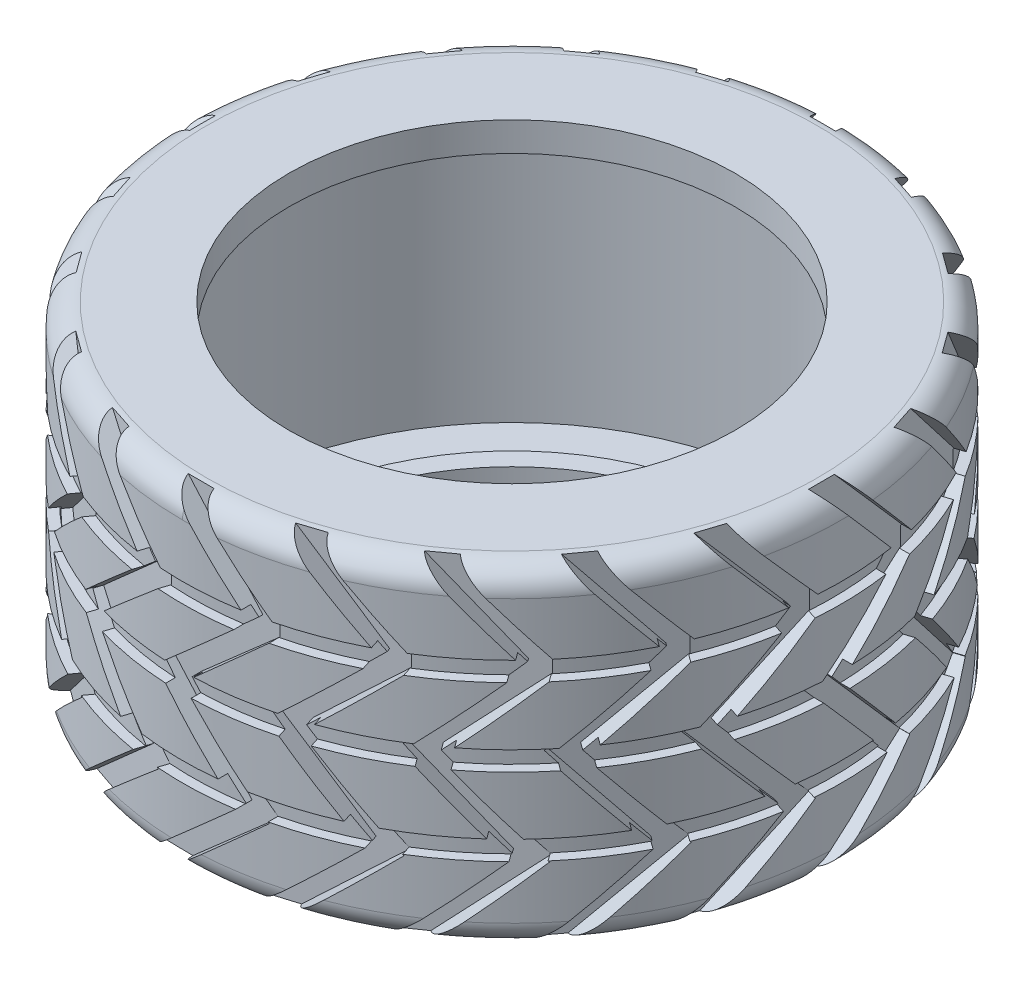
SolidWorks part; units mm, degrees
ref_plane "Front Plane" through (0, 0, 0) normal (0, 0, 1) x (1, 0, 0)
ref_plane "Top Plane" through (0, 0, 0) normal (0, 1, 0) x (1, 0, 0)
ref_plane "Right Plane" through (0, 0, 0) normal (1, 0, 0) x (0, 0, -1)
sketch "Sketch1" plane through (0, 0, 0) normal (0, 0, 1) x (1, 0, 0)
  line L0 (0, 83.6379) -> (0, -103.1897) construction
  line L1 (31.5, -17) -> (23, -17)
  line L2 (23, -17) -> (23, -14)
  line L3 (23, -14) -> (25, -14)
  line L4 (25, -14) -> (25, -15)
  line L5 (30, 15) -> (30, -15)
  line L6 (25, -15) -> (30, -15)
  line L7 (25, 15) -> (30, 15)
  line L8 (25, 14) -> (25, 15)
  line L9 (23, 14) -> (25, 14)
  line L10 (-63.3434, 0) -> (34, 0) construction
  line L11 (23, 17) -> (23, 14)
  line L12 (34, 14.5) -> (34, -14.5)
  line L13 (31.5, 17) -> (23, 17)
  arc A0 (34, -14.5) -> (31.5, -17) centre (31.5, -14.5) cw
  arc A1 (34, 14.5) -> (31.5, 17) centre (31.5, 14.5) ccw
  point P19 (34, -19)
  point P21 (30, 0)
  point P24 (34, 19)
  dimension "D8" = 2.5
  dimension "D1" = 30
  dimension "D2" = 2
  dimension "D3" = 2
  dimension "D4" = 15
  dimension "D5" = 3
  dimension "D6" = 5
  dimension "D7" = 4
revolve "Revolve1" add sketch "Sketch1" angle 360 about L0
sketch "Sketch2" plane through (0, 0, 0) normal (0, 0, 1) x (1, 0, 0)
  line L0 (-5.8704, 0) -> (53.8139, 0) construction
  line L1 (33, 9) -> (35.7422, 9)
  line L2 (33, 9) -> (33, 7)
  line L3 (33, 7) -> (35.7422, 7)
  line L4 (35.7422, 9) -> (35.7422, 7)
  line L5 (33, 1) -> (35.7422, 1)
  line L6 (33, 1) -> (33, -1)
  line L7 (33, -1) -> (35.7422, -1)
  line L8 (35.7422, 1) -> (35.7422, -1)
  line L9 (33, -7) -> (35.7422, -7)
  line L10 (33, -7) -> (33, -9)
  line L11 (33, -9) -> (35.7422, -9)
  line L12 (35.7422, -7) -> (35.7422, -9)
  line L13 (34, -14.5) -> (34, 14.5) construction
  line L14 (0, 29.8282) -> (0, -32.6074) construction
  line L15 (0, -32.6074) -> (-0.69, -32.6074) construction
  dimension "D1" = 2
  dimension "D2" = 1
  dimension "D3" = 9
revolve "Cut-Revolve1" cut sketch "Sketch2" angle 360 about L14
ref_plane "Plane1" through (34, 0, 0) normal (1, 0, 0) x (0, 0, -1)
sketch "Sketch3" plane through (34, 0, 0) normal (1, 0, 0) x (0, 0, -1)
  line L0 (0, 0) -> (9.1133, 8)
  line L1 (9.1133, 8) -> (1.1133, 17.1133)
  line L2 (0, 0) -> (8, -9.1133)
  line L3 (8, -9.1133) -> (-1.1133, -17.1133)
  line L4 (2.3901, 8) -> (13.9243, 8) construction
  line L5 (0, 18.3998) -> (0, -22.4709) construction
  line L6 (6.2909, 8.1836) -> (-0.3897, 15.7939) construction
  line L7 (1.1133, 17.1133) -> (-1.548, 17.1133)
  line L8 (-0.2479, 15.6324) -> (-1.548, 17.1133)
  line L9 (-2.4327, -15.6103) -> (-4.1449, -17.1133)
  line L10 (-33, 9) -> (33, 9) construction
  line L11 (34, 7) -> (-34, 7) construction
  line L12 (5.1775, -8.9297) -> (-2.4327, -15.6103)
  line L13 (-2.8225, 0.1836) -> (5.1775, -8.9297)
  line L14 (-2.8225, 0.1836) -> (6.2909, 8.1836)
  line L15 (6.2909, 8.1836) -> (-0.2479, 15.6324)
  line L16 (-1.1133, -17.1133) -> (-4.1449, -17.1133)
  dimension "D1" = 2
extrude "Cut-Extrude1" cut sketch "Sketch3" against normal blind 2
pattern_circular "CirPattern1" count 20 over 360 about axis through (0, 0, 0) along (0, 1, 0) of "Cut-Extrude1"
